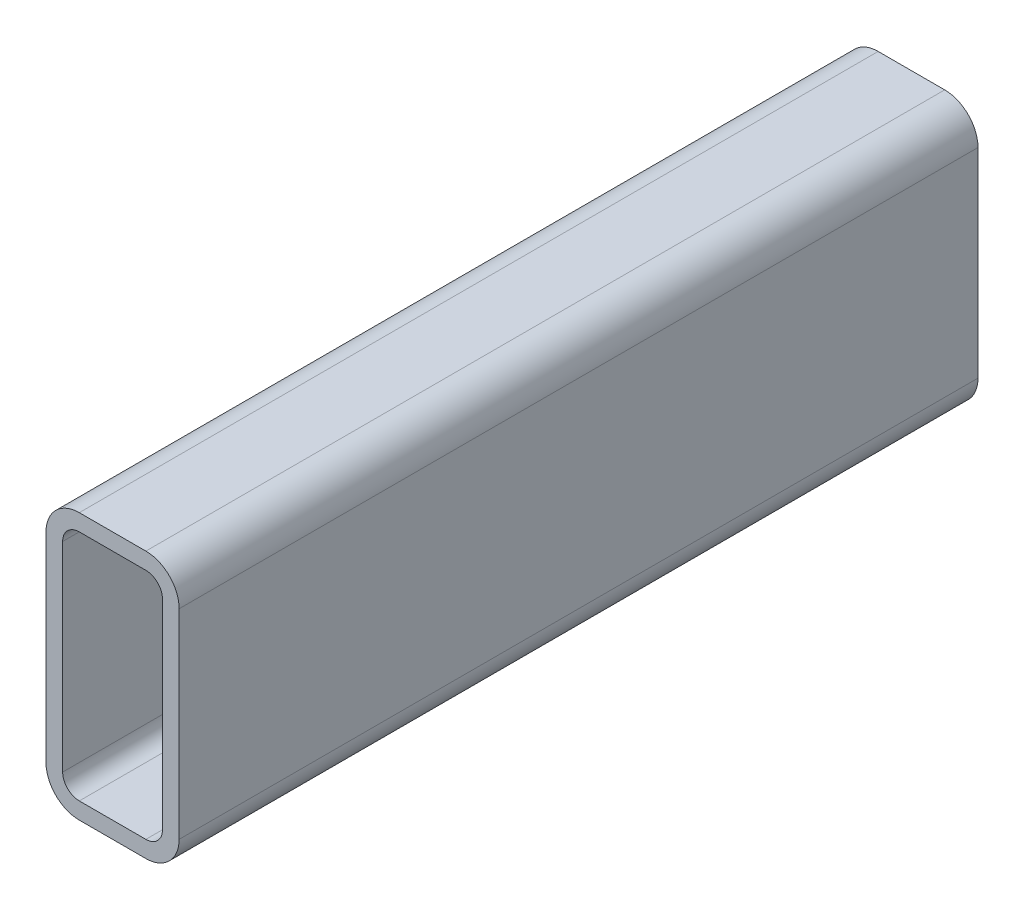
SolidWorks part; units mm, degrees
ref_plane "Front Plane" through (0, 0, 0) normal (0, 0, 1) x (1, 0, 0)
ref_plane "Top Plane" through (0, 0, 0) normal (0, 1, 0) x (1, 0, 0)
ref_plane "Right Plane" through (0, 0, 0) normal (1, 0, 0) x (0, 0, -1)
sketch "Sketch1" plane through (0, 0, 0) normal (0, 0, 1) x (1, 0, 0)
  line B0 (12.7, 101.6) -> (38.1, 101.6)
  arc B1 (50.8, 88.9) -> (38.1, 101.6) centre (38.1, 88.9) ccw
  line B2 (50.8, 88.9) -> (50.8, 12.7)
  arc B3 (38.1, 0) -> (50.8, 12.7) centre (38.1, 12.7) ccw
  line B4 (38.1, 0) -> (12.7, 0)
  arc B5 (0, 12.7) -> (12.7, 0) centre (12.7, 12.7) ccw
  line B6 (0, 12.7) -> (0, 88.9)
  arc B7 (12.7, 101.6) -> (0, 88.9) centre (12.7, 88.9) ccw
  line B8 (12.7, 95.25) -> (38.1, 95.25)
  arc B9 (44.45, 88.9) -> (38.1, 95.25) centre (38.1, 88.9) ccw
  line B10 (44.45, 88.9) -> (44.45, 12.7)
  arc B11 (38.1, 6.35) -> (44.45, 12.7) centre (38.1, 12.7) ccw
  line B12 (38.1, 6.35) -> (12.7, 6.35)
  arc B13 (6.35, 12.7) -> (12.7, 6.35) centre (12.7, 12.7) ccw
  line B14 (6.35, 12.7) -> (6.35, 88.9)
  arc B15 (12.7, 95.25) -> (6.35, 88.9) centre (12.7, 88.9) ccw
sketch_block_instance "HSS4x2x0.250-1"
sketch_block "HSS4x2x0.250"
extrude "Boss-Extrude1" add sketch "Sketch1" along normal blind 304.8
